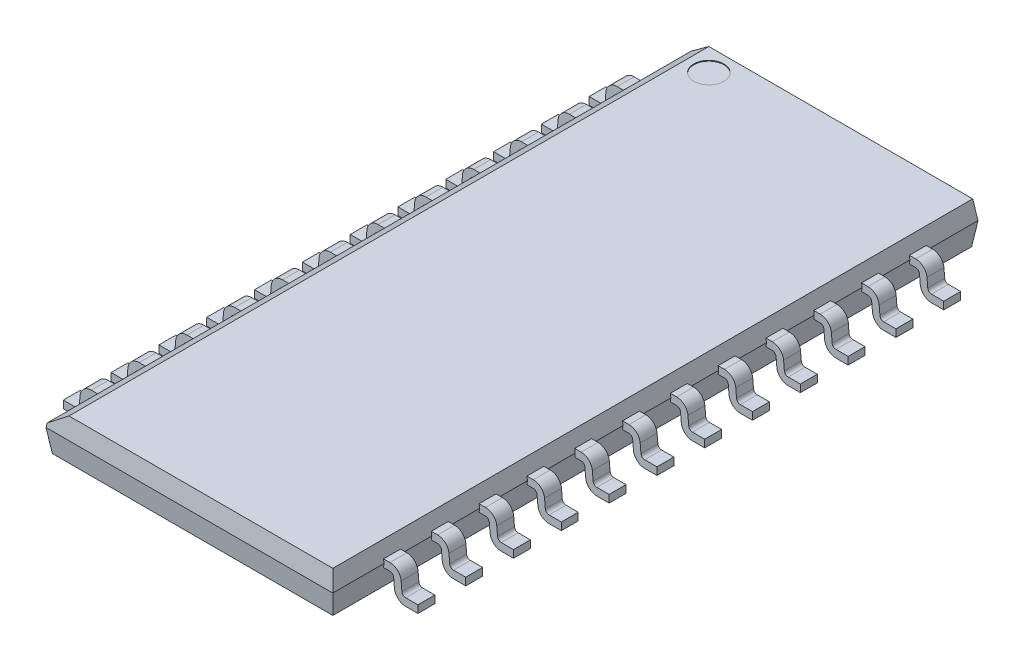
SolidWorks part; units mm, degrees
ref_plane "Front" through (0, 0, 0) normal (0, 0, 1) x (1, 0, 0)
ref_plane "Top" through (0, 0, 0) normal (0, 1, 0) x (1, 0, 0)
ref_plane "Right" through (0, 0, 0) normal (1, 0, 0) x (0, 0, -1)
ref_plane "ПлоскостьВывод1" through (0, 0, -6.985) normal (0, 0, 1) x (1, 0, 0)
sketch "ЭскизВывод1" plane through (0, 0, -6.985) normal (0, 0, 1) x (1, 0, 0)
  line L0 (-4.71, 0) -> (-4.3849, 0)
  line L1 (-4.086, 0.2739) -> (-4.0655, 0.5087)
  line L2 (-3.9659, 0.6) -> (3.9659, 0.6)
  line L3 (0, 0.6) -> (0, 0) construction
  line L4 (4.086, 0.2739) -> (4.0655, 0.5087)
  line L5 (4.71, 0) -> (4.3849, 0)
  arc A0 (-4.0655, 0.5087) -> (-3.9659, 0.6) centre (-3.9659, 0.5) cw
  arc A1 (-4.3849, 0) -> (-4.086, 0.2739) centre (-4.3849, 0.3) ccw
  arc A2 (4.3849, 0) -> (4.086, 0.2739) centre (4.3849, 0.3) cw
  arc A3 (4.0655, 0.5087) -> (3.9659, 0.6) centre (3.9659, 0.5) ccw
  point P8 (-4.0575, 0.6)
  point P11 (-4.11, 0)
  dimension "D6" = 0.1
  dimension "D7" = 0.3
  dimension "E" = 9.42
  dimension "A_mid_lead" = 0.6
  dimension "L" = 0.6
  dimension "D4" = 85
  dimension "D5" = 8.115
extrude "Вывод1" add sketch "ЭскизВывод1" along normal mid plane 0.45 thin
ref_plane "ПлоскостьКорпус" through (0, 0.7, 0) normal (0, 1, 0) x (-1, 0, 0)
sketch "ЭскизКорпус" plane through (0, 0.7, 0) normal (0, 1, 0) x (1, 0, 0)
  line L1 (3.81, -8.57) -> (-3.81, -8.57)
  line L2 (3.81, -8.57) -> (3.81, 8.57)
  line L3 (3.81, 8.57) -> (-3.81, 8.57)
  line L4 (-3.81, -8.57) -> (-3.81, 8.57)
  line L5 (3.81, -8.57) -> (-3.81, 8.57) construction
  line L6 (3.81, 8.57) -> (-3.81, -8.57) construction
  point P0 (0, 0)
  dimension "D" = 17.14
  dimension "E" = 7.62
extrude "Корпус" add sketch "ЭскизКорпус" along normal offset from surface 1.2 draft 8 and the other way offset from surface (0.6 mm away) 0.1 draft 8
pattern_linear "Выводы" count 12 spacing 1.27 along (0, 0, 1) of "Вывод1"
chamfer "Фаска1" distance 0.4 angle 45 1 edges at (-3.7397, 1.2, 0)
sketch "Эскиз3" plane through (0, 1.2, 0) normal (0, 1, 0) x (1, 0, 0)
  line L0 (-3.2697, 7.8997) -> (-2.6697, 7.8997) construction
  line L1 (-3.2697, 8.4997) -> (-3.2697, -8.4997) construction
  line L2 (-2.6697, 7.8997) -> (-2.6697, 8.4997) construction
  line L3 (3.7397, 8.4997) -> (-3.2697, 8.4997) construction
  circle A0 centre (-2.6697, 7.8997) radius 0.4
  dimension "D2" = 0.8
  dimension "D1" = 0.6
extrude "Вытянуть3" cut sketch "Эскиз3" against normal blind 0.02
sketch "SkThermalPad" plane through (0, 0.7, 0) normal (0, 1, 0) x (-1, 0, 0)
  line L1 (1.25, 1.25) -> (-1.25, 1.25)
  line L2 (1.25, 1.25) -> (1.25, -1.25)
  line L3 (1.25, -1.25) -> (-1.25, -1.25)
  line L4 (-1.25, 1.25) -> (-1.25, -1.25)
  line L5 (1.25, 1.25) -> (-1.25, -1.25) construction
  line L6 (1.25, -1.25) -> (-1.25, 1.25) construction
  point P0 (0, 0)
  dimension "D1" = 2.5
  dimension "E2" = 2.5
extrude "ThermalPad" [suppressed] add sketch "SkThermalPad" against normal up to surface (0.95 mm away)
